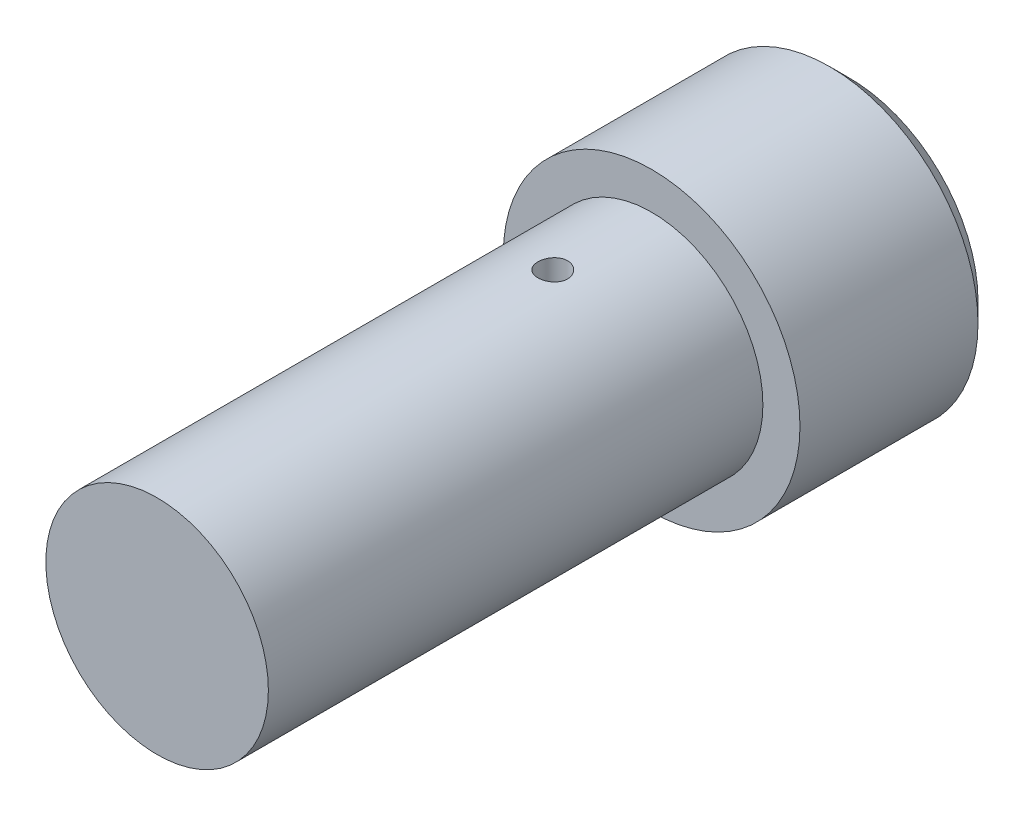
SolidWorks part; units mm, degrees
ref_plane "Plan1" through (0, 0, 0) normal (0, 0, 1) x (1, 0, 0)
ref_plane "Plan2" through (0, 0, 0) normal (0, 1, 0) x (1, 0, 0)
ref_plane "Plan3" through (0, 0, 0) normal (1, 0, 0) x (0, 0, -1)
sketch "Esquisse1" plane through (0, 0, 0) normal (0, 0, 1) x (1, 0, 0)
  circle A0 centre (0, 0) radius 30
extrude "Base-Extrusion" add sketch "Esquisse1" along normal blind 40
sketch "Esquisse2" plane through (0, 0, 40) normal (0, 0, 1) x (1, 0, 0)
  circle A0 centre (0, 0) radius 22.5
extrude "Boss.-Extru.1" add sketch "Esquisse2" along normal blind 100
ref_plane "Plan4" through (0, 30, 0) normal (0, 1, 0) x (-1, 0, 0)
sketch "Esquisse3" plane through (0, 30, 0) normal (0, 1, 0) x (-1, 0, 0)
  line L0 (0, 40) -> (0, 0) construction
  circle A0 centre (0, 60) radius 3
extrude "Enlèv. mat.-Extru.1" cut sketch "Esquisse3" against normal blind 30
chamfer "Chanfrein1" distance 4 angle 45
